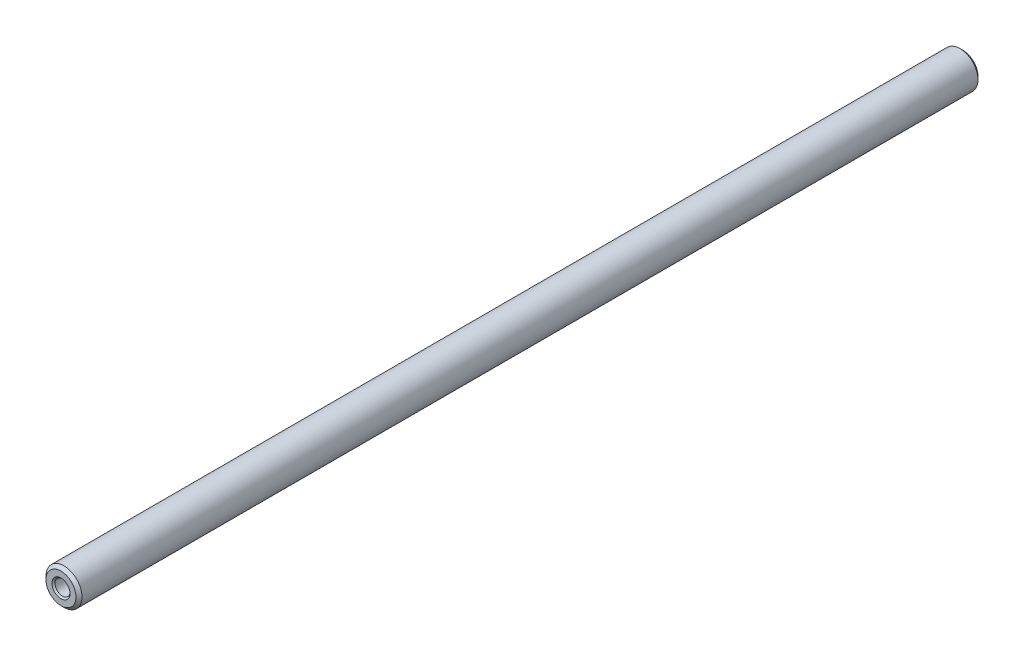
SolidWorks part; units mm, degrees
ref_plane "Front Plane" through (0, 0, 0) normal (0, 0, 1) x (1, 0, 0)
ref_plane "Top Plane" through (0, 0, 0) normal (0, 1, 0) x (1, 0, 0)
ref_plane "Right Plane" through (0, 0, 0) normal (1, 0, 0) x (0, 0, -1)
sketch "Sketch1" plane through (0, 0, 0) normal (0, 0, 1) x (1, 0, 0)
  circle A0 centre (0, 0) radius 2.995
  dimension "D1" = 5.99
extrude "Boss-Extrude1" add sketch "Sketch1" along normal blind 150
hole_wizard "M3x0.5 Tapped Hole1" positions "Sketch5" profile "Sketch4" tap size "M3x0.5" standard "Ansi Metric"
sketch "Sketch5" plane through (0, 0, 150) normal (0, 0, 1) x (1, 0, 0)
  circle A0 centre (0, 0) radius 2.995 construction
  point P0 (0, 0)
sketch "Sketch4" plane through (0, 0, 150) normal (1, 0, 0) x (0, -1, 0)
  line L0 (0, 0) -> (0, 3.7511)
  line L1 (0, 3.7511) -> (1.25, 3)
  line L2 (1.25, 3) -> (1.25, 0.25)
  line L3 (1.25, 0.25) -> (1.5, 0)
  line L5 (1.5, 0) -> (0, 0)
  line L6 (-1.25, 0.25) -> (-1.5, 0) construction
  line L10 (0, 3.7511) -> (-1.25, 3) construction
  line L11 (0, -6.35) -> (0, 107.95) construction
  dimension "Tap Drill Dia." = 2.5
  dimension "Tap Drill Depth" = 3
  dimension "Near C'Sink Dia." = 3
  dimension "Near C'Sink Angle" = 90
  dimension "Drill Angle" = 118
hole_wizard "M3x0.5 Tapped Hole2" positions "Sketch7" profile "Sketch6" tap size "M3x0.5" standard "Ansi Metric"
sketch "Sketch7" plane through (0, 0, 0) normal (0, 0, -1) x (-1, 0, 0)
  circle A0 centre (0, 0) radius 2.995 construction
  point P0 (0, 0)
sketch "Sketch6" plane through (0, 0, 0) normal (1, 0, 0) x (0, 1, 0)
  line L0 (0, 0) -> (0, 3.7511)
  line L1 (0, 3.7511) -> (1.25, 3)
  line L2 (1.25, 3) -> (1.25, 0.25)
  line L3 (1.25, 0.25) -> (1.5, 0)
  line L5 (1.5, 0) -> (0, 0)
  line L6 (-1.25, 0.25) -> (-1.5, 0) construction
  line L10 (0, 3.7511) -> (-1.25, 3) construction
  line L11 (0, -6.35) -> (0, 107.95) construction
  dimension "Tap Drill Dia." = 2.5
  dimension "Tap Drill Depth" = 3
  dimension "Near C'Sink Dia." = 3
  dimension "Near C'Sink Angle" = 90
  dimension "Drill Angle" = 118
chamfer "Chamfer1" distance 0.5 angle 45 2 edges at (2.995, 0, 0) (2.995, 0, 150)
